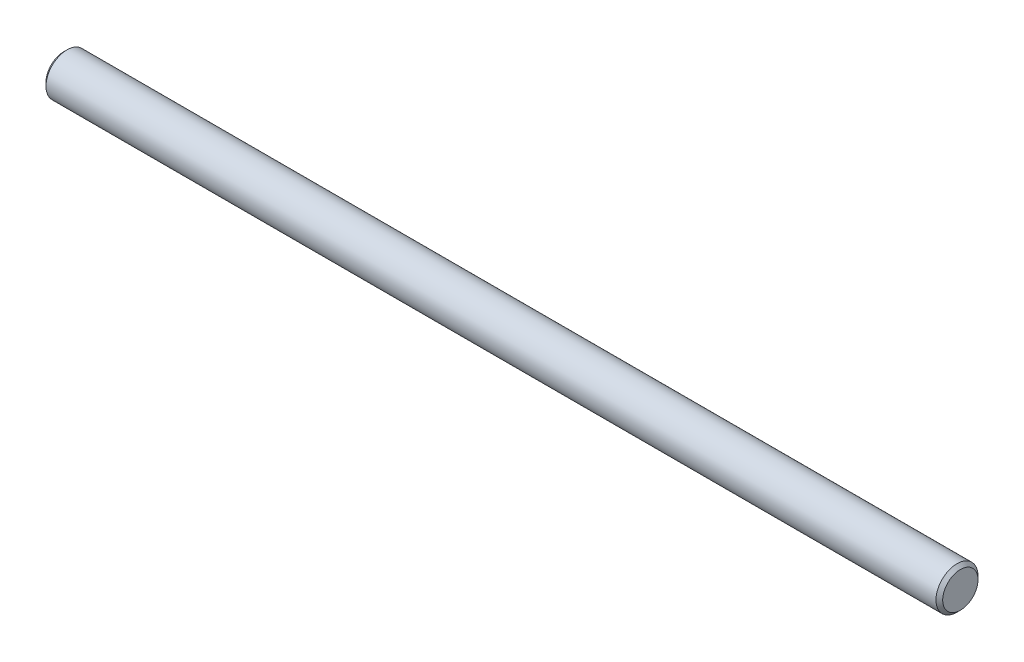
SolidWorks part; units mm, degrees
ref_plane "Front" through (0, 0, 0) normal (0, 0, 1) x (1, 0, 0)
ref_plane "Top" through (0, 0, 0) normal (0, 1, 0) x (1, 0, 0)
ref_plane "Right" through (0, 0, 0) normal (1, 0, 0) x (0, 0, -1)
sketch "Sketch1" plane through (0, 0, 0) normal (1, 0, 0) x (0, 0, -1)
  circle A0 centre (0, 0) radius 2.3812
  dimension "D1" = 4.7625
extrude "Extrude1" add sketch "Sketch1" along normal mid plane 101.6
chamfer "Chamfer1" distance 0.381 angle 45 2 edges at (-50.8, 0, -2.3812) (50.8, 0, -2.3812)
